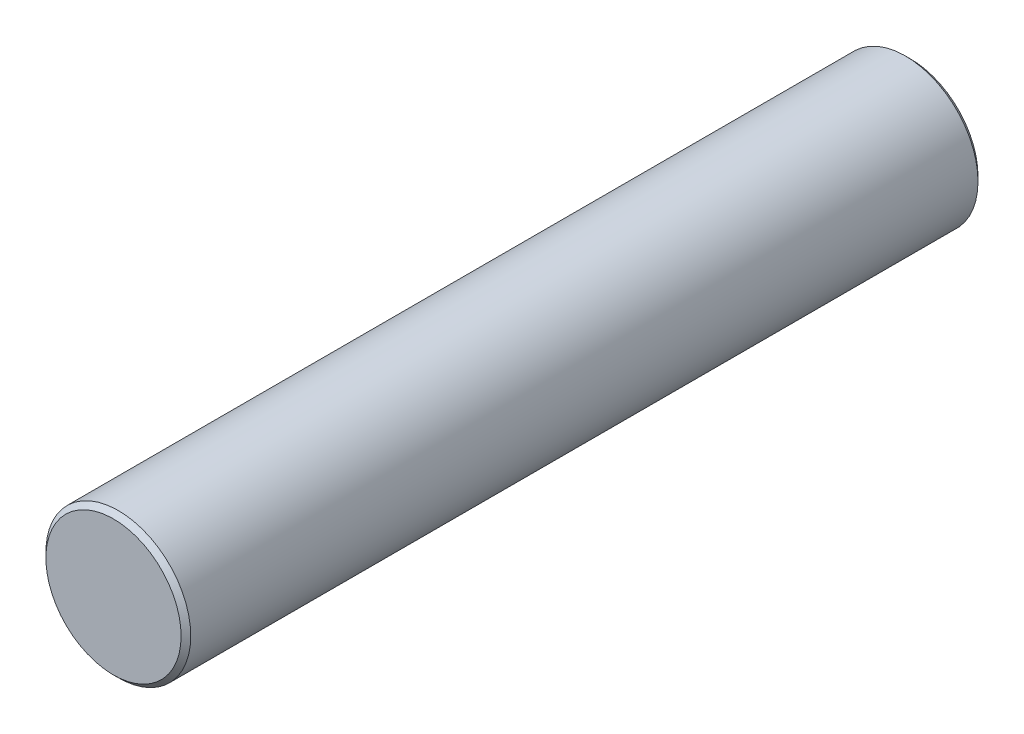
SolidWorks part; units mm, degrees
ref_plane "前视基准面" through (0, 0, 0) normal (0, 0, 1) x (1, 0, 0)
ref_plane "上视基准面" through (0, 0, 0) normal (0, 1, 0) x (1, 0, 0)
ref_plane "右视基准面" through (0, 0, 0) normal (1, 0, 0) x (0, 0, -1)
sketch "草图1" plane through (0, 0, 0) normal (0, 0, 1) x (1, 0, 0)
  circle A0 centre (0, 0) radius 1.5
  dimension "D1" = 3
extrude "凸台-拉伸1" add sketch "草图1" along normal mid plane 16.5
chamfer "倒角1" distance 0.1 angle 45 2 edges at (1.5, 0, -8.25) (1.5, 0, 8.25)
equation "\"Dummy1\"= \"图号代码\""
equation "\"Dummy2\"= \"名称代码\""
